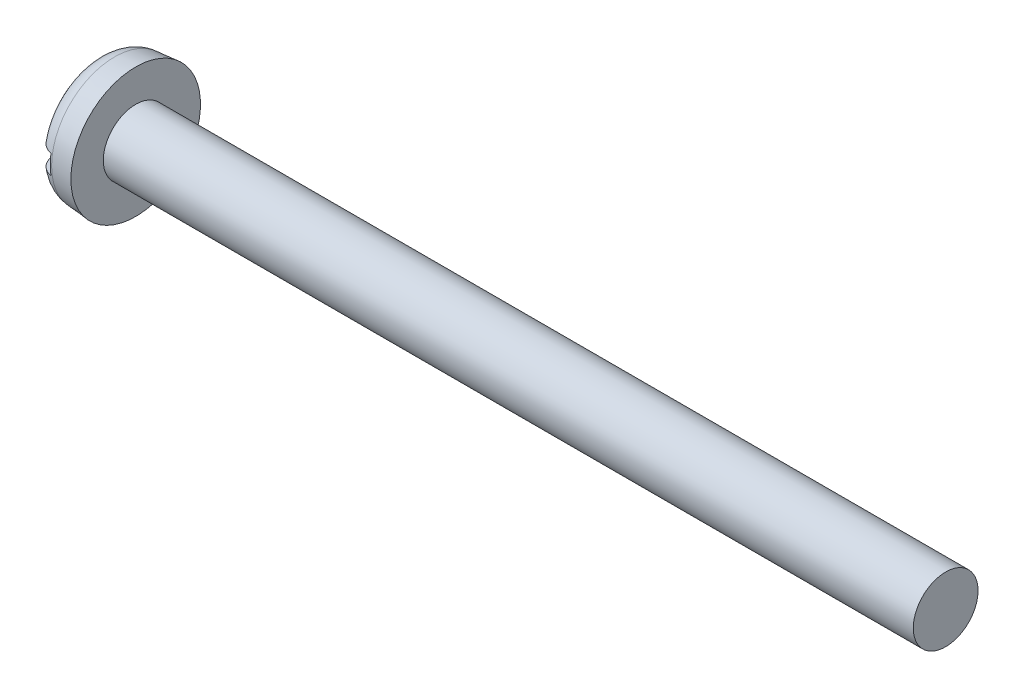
SolidWorks part; units mm, degrees
ref_plane "Plane1" through (0, 0, 0) normal (0, 0, 1) x (1, 0, 0)
ref_plane "Plane2" through (0, 0, 0) normal (0, 1, 0) x (1, 0, 0)
ref_plane "Plane3" through (0, 0, 0) normal (1, 0, 0) x (0, 0, -1)
sketch "BodySke" plane through (0, 0, 0) normal (0, 0, 1) x (1, 0, 0)
  line L0 (2.4, 2) -> (2.4, 4)
  line L1 (0, 0) -> (0, 3.79)
  line L2 (-25.4, 0) -> (127, 0) construction
  line L3 (52.4, 0) -> (0, 0)
  line L4 (2.4, 2) -> (52.4, 2)
  line L5 (52.4, 2) -> (52.4, 0)
  line L6 (0, 3.79) -> (2.4, 4)
  line L9 (3.1, 3.5875) -> (3.1, -5.9375) construction
  line L10 (2.4, 6.35) -> (2.4, -3.175) construction
revolve "Base-Revolve" add sketch "BodySke"
fillet "Fillet1" [suppressed] radius 0.2
fillet "Fillet2" radius 1.2 1 edges at (0, 0, 3.79)
sketch "Sketch2" plane through (0, 0, 0) normal (1, 0, 0) x (0, 0, -1)
  line L0 (4, -0.6) -> (-4, -0.6)
  line L1 (4, -0.6) -> (4, 0.6)
  line L2 (-4, 0.6) -> (4, 0.6)
  line L3 (-4, 0.6) -> (-4, -0.6)
extrude "Slot" cut sketch "Sketch2" along normal blind 1
sketch "ThdSchSke" plane through (0, 0, 0) normal (0, 0, 1) x (1, 0, 0)
  line L0 (3.8, -1.61) -> (3.5269, -2)
  line L1 (3.8, -1.61) -> (4.0731, -2)
  line L2 (4.0731, -2) -> (4.0731, -2.5)
  line L3 (-3.175, 0) -> (5.1513, 0) construction
  line L5 (4.0731, -2.5) -> (3.5269, -2.5)
  line L6 (3.5269, -2.5) -> (3.5269, -2)
revolve "ThreadSchematic" [suppressed] cut sketch "ThdSchSke" angle 360 about L3
pattern_linear "ThdSchPat" [suppressed]
equation "\"D1@Sketch2\" = \"Head_dia@BodySke\""
equation "\"D2@Sketch2\" = \"D1@Sketch2\" / 2"
equation "\"D3@Sketch2\" = \"Slot_width@Sketch2\" / 2"
equation "\"Thread_length@ThreadCosmetic\" = ((sgn( (\"Length@BodySke\" - \"Advance@BodySke\" * 2.0 ) - \"Thread_nom@BodySke\" )-1)*( (\"Length@BodySke\" - \"Advance@BodySke\"  * 2.0) - \"Thread_nom@BodySke\" ))/-2+ \"Thread_"
equation "\"Thread_minor@ThdSchSke\" = \"Thread_minor@ThreadCosmetic\""
equation "\"Diameter@ThdSchSke\" = \"Diameter@BodySke\""
equation "\"Overcut@ThdSchSke\" = \"Diameter@BodySke\" * 1.25"
equation "\"Start@ThdSchSke\" = \"Head_ht@BodySke\" + \"Length@BodySke\" - \"Thread_length@ThreadCosmetic\"  '---Non-countersunk---"
equation "\"Num_threads@ThdSchPat\" = int( \"Thread_length@ThreadCosmetic\" / \"Advance@BodySke\" + 0.999 )  + 1"
equation "\"Advance@ThdSchPat\" = \"Thread_length@ThreadCosmetic\" /  (\"Num_threads@ThdSchPat\" - 1) 'relax it"
